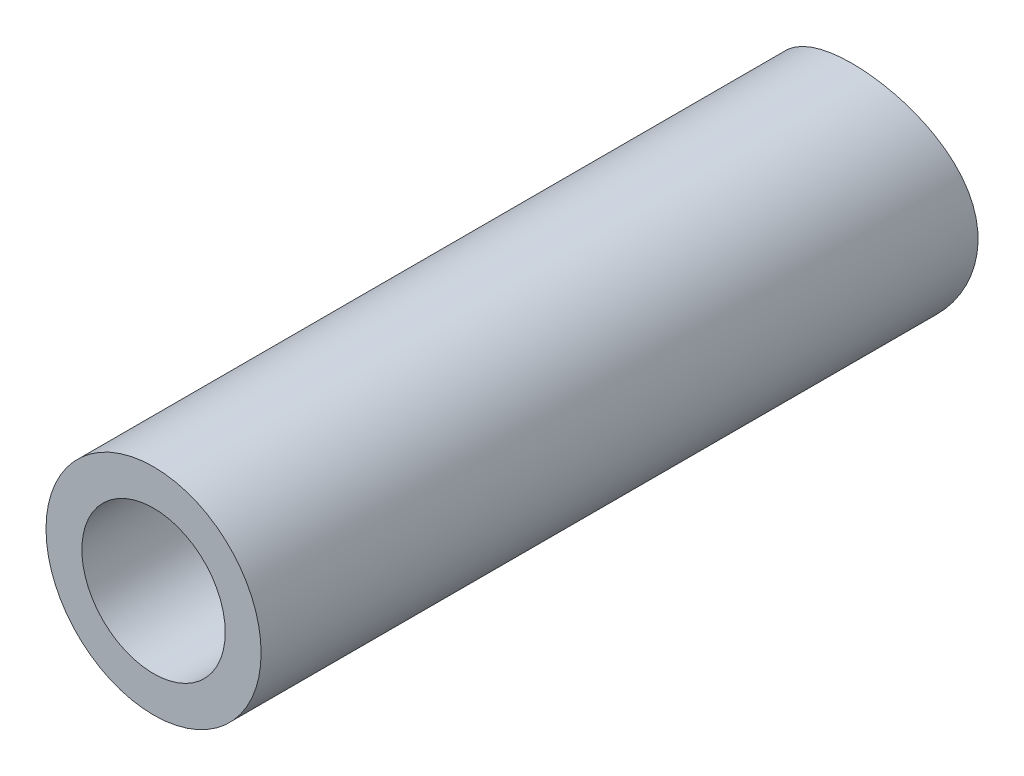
SolidWorks part; units mm, degrees
ref_plane "Front" through (0, 0, 0) normal (0, 0, 1) x (1, 0, 0)
ref_plane "Top" through (0, 0, 0) normal (0, 1, 0) x (1, 0, 0)
ref_plane "Right" through (0, 0, 0) normal (1, 0, 0) x (0, 0, -1)
sketch "Sketch1" plane through (0, 0, 0) normal (0, 0, 1) x (1, 0, 0)
  circle A0 centre (0, 0) radius 7.5
extrude "Extrude1" add sketch "Sketch1" along normal blind 50
sketch "Sketch2" plane through (0, 0, 0) normal (0, 1, 0) x (1, 0, 0)
  line L0 (0, 0) -> (0, 42.4264) construction
  circle A0 centre (0, 21.2132) radius 22.5
  dimension "D1" = 45
extrude "Cut-Extrude1" cut sketch "Sketch2" against normal mid plane 50
sketch "Sketch3" plane through (0, 0, 50) normal (0, 0, 1) x (1, 0, 0)
  circle A0 centre (0, 0) radius 5
extrude "Cut-Extrude2" cut sketch "Sketch3" against normal blind 30
sketch "Sketch4" plane through (0, 0, 0) normal (0, 0, 1) x (1, 0, 0)
  circle A0 centre (0, 0) radius 2
extrude "Cut-Extrude3" cut sketch "Sketch4" along normal blind 10
